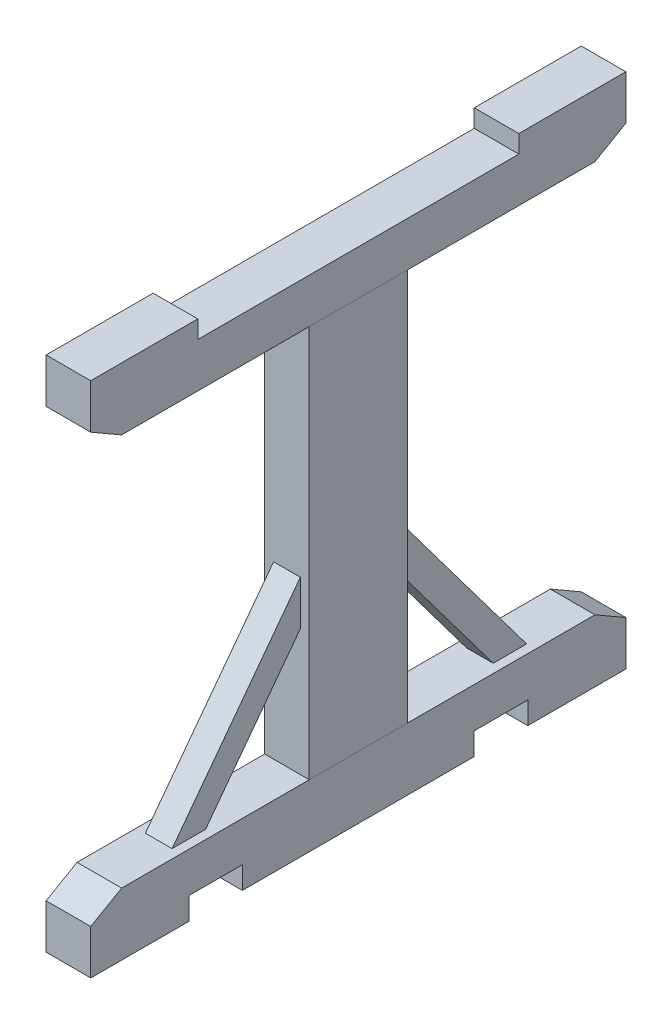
SolidWorks part; units mm, degrees
other "Main_support"
other "Upper_Brace2"
other "Upper_Brace1"
ref_plane "Front Plane" through (0, 0, 0) normal (0, 0, 1) x (1, 0, 0)
ref_plane "Top Plane" through (0, 0, 0) normal (0, 1, 0) x (1, 0, 0)
ref_plane "Right Plane" through (0, 0, 0) normal (1, 0, 0) x (0, 0, -1)
sketch3d "3DSketch1"
  line L3 (-35.8179, 0, 0) -> (-35.8179, 558.8, 0)
  line L4 (-35.8179, 558.8, 279.4) -> (-35.8179, 254, 0)
  line L7 (-35.8179, 558.8, 381) -> (-35.8179, 558.8, -381)
  line L10 (-35.8179, 254, 0) -> (-35.8179, 558.8, -279.4)
  line L14 (-35.8179, 0, 228.6) -> (-35.8179, 0, -228.6) construction
  line L17 (-35.8179, 304.8, 0) -> (-35.8179, 0, 228.6)
  line L18 (-35.8179, 304.8, 0) -> (-35.8179, 0, -228.6)
  line L19 (-35.8179, 0, 381) -> (-35.8179, 0, -381)
  line L22 (-35.8179, 0, 0) -> (-35.8179, -105.3822, 0) construction
  dimension "D1" = 762
  dimension "D2" = 762
  dimension "D4" = 457.2
  dimension "D3" = 558.8
  dimension "D6" = 558.8
  dimension "D7" = 304.8
  dimension "D9" = 304.8
other "Structural Member1"
ref_plane "Plane1" through (-35.8179, 558.8, 381) normal (0, 0, -1) x (0, -1, 0)
sketch "Sketch117" plane through (-4.0679, 647.7, 381) normal (0, 0, -1) x (0, -1, 0)
  line L0 (0, 31.75) -> (88.9, 31.75) construction
  line L1 (0, 0) -> (88.9, 0)
  line L2 (0, 0) -> (0, 63.5)
  line L3 (0, 63.5) -> (88.9, 63.5)
  line L4 (88.9, 0) -> (88.9, 63.5)
  point P7 (0, 0)
  dimension "D1" = 63.5
  dimension "D2" = 88.9
other "Structural Member2"
ref_plane "Plane2" through (-35.8179, 0, 0) normal (0, 1, 0) x (0, 0, -1)
sketch "Sketch1" plane through (-4.0679, 0, 69.85) normal (0, 1, 0) x (0, 0, -1)
  line L0 (0, 31.75) -> (139.7, 31.75) construction
  line L1 (0, 0) -> (139.7, 0)
  line L2 (0, 0) -> (0, 63.5)
  line L3 (0, 63.5) -> (139.7, 63.5)
  line L4 (139.7, 0) -> (139.7, 63.5)
  point P7 (69.85, 0)
  point P8 (69.85, 31.75)
  point P9 (69.85, 63.5)
  point P10 (0, 0)
  dimension "D1" = 63.5
  dimension "D2" = 139.7
other "Structural Member5"
ref_plane "Plane5" through (-35.8179, 304.8, 0) normal (0, -0.8, 0.6) x (0, 0.6, 0.8)
sketch "Sketch115" plane through (-16.7679, 293.37, -15.24) normal (0, -0.8, 0.6) x (0, 0.6, 0.8)
  line L0 (0, 38.1) -> (38.1, 0) construction
  line L1 (0, 0) -> (38.1, 0)
  line L2 (0, 0) -> (0, 38.1)
  line L3 (0, 38.1) -> (38.1, 38.1)
  line L4 (38.1, 0) -> (38.1, 38.1)
  line L5 (38.1, 38.1) -> (0, 0) construction
  point P4 (19.05, 0)
  point P5 (19.05, 19.05)
  point P7 (0, 19.05)
  point P8 (38.1, 19.05)
  point P9 (19.05, 38.1)
  point P10 (0, 0)
  dimension "D1" = 38.1
  dimension "D2" = 38.1
other "Trim/Extend5"
sketch "Sketch17" plane through (-4.0679, 0, 0) normal (1, 0, 0) x (0, 0, -1)
  line L0 (-228.6, 647.7) -> (-228.6, 622.3)
  line L2 (-228.6, 622.3) -> (228.6, 622.3)
  line L3 (228.6, 622.3) -> (228.6, 647.7)
  line L4 (381, 647.7) -> (-381, 647.7) construction
  line L9 (0, 117.2167) -> (0, 622.3) construction
  dimension "D1" = 457.2
  dimension "D3" = 25.4
extrude "Cut-Extrude1" cut sketch "Sketch17" against normal through all and the other way through all contours L0 L2 L3
chamfer "Chamfer1" distance 25.4 angle 60 2 edges at (-35.8179, 558.8, -381) (-35.8179, 558.8, 381)
sketch "Sketch19" plane through (-4.0679, 0, 0) normal (1, 0, 0) x (0, 0, -1)
  line L0 (0, 0) -> (0, -403.6391) construction
  line L3 (165.1, -88.9) -> (241.3, -88.9)
  line L4 (165.1, -88.9) -> (165.1, -57.15)
  line L5 (165.1, -57.15) -> (241.3, -57.15)
  line L6 (241.3, -88.9) -> (241.3, -57.15)
  line L7 (-241.3, -88.9) -> (-241.3, -57.15)
  line L8 (-165.1, -57.15) -> (-241.3, -57.15)
  line L9 (-165.1, -88.9) -> (-165.1, -57.15)
  line L10 (-165.1, -88.9) -> (-241.3, -88.9)
  line L11 (381, 0) -> (-381, 0) construction
  line L12 (381, -88.9) -> (-381, -88.9) construction
  dimension "D1" = 31.75
  dimension "D2" = 76.2
  dimension "D3" = 330.2
extrude "Cut-Extrude3" cut sketch "Sketch19" against normal up to next
ref_plane "Joining_Face" through (0, 0, 0) normal (0, 1, 0) x (-1, 0, 0)
sketch "Sketch4" plane through (0, 0, 0) normal (0, 1, 0) x (-1, 0, 0)
  line L0 (67.5679, -69.85) -> (4.0679, 69.85) construction
  line L1 (67.5679, -69.85) -> (67.5679, 69.85)
  line L2 (67.5679, -69.85) -> (4.0679, -69.85)
  line L3 (4.0679, -69.85) -> (4.0679, 69.85)
  line L4 (67.5679, 69.85) -> (4.0679, 69.85)
  line L5 (35.8179, -44.45) -> (35.8179, 44.45)
  line L6 (42.1679, -69.85) -> (42.1679, -68.85) construction
  line L7 (67.5679, -69.85) -> (42.1679, -69.85)
  line L8 (4.0679, -69.85) -> (4.0679, 69.85) construction
  point P13 (35.8179, 0)
  dimension "D1" = 88.9
  dimension "Dowel_side_inset" = 25.4
  dimension "Width" = 139.7
  dimension "Dowel_hole_end_gap" = 1
sketch "Master_sketch" plane through (0, 0, 0) normal (0, 1, 0) x (-1, 0, 0)
  circle A0 centre (35.8179, -44.45) radius 5.1
  circle A1 centre (35.8179, -44.45) radius 5
  dimension "Dowel_Diameter" = 10
  dimension "Dowel_Clearance" = 0.1
sketch "Sketch6" plane through (0, 0, 0) normal (0, 1, 0) x (-1, 0, 0)
  circle A0 centre (35.8179, -44.45) radius 5.1 construction
  circle A1 centre (35.8179, -44.45) radius 5.1
  circle A2 centre (35.8179, 44.45) radius 5.1
extrude "Cut-Extrude11" cut sketch "Sketch6" against normal mid plane 32
sketch "Sketch7" plane through (0, 0, 0) normal (0, 1, 0) x (-1, 0, 0)
  circle A0 centre (35.8179, -44.45) radius 5 construction
  circle A1 centre (35.8179, -44.45) radius 5
extrude "Dowel1" add sketch "Sketch7" along normal mid plane 30 separate body
sketch "Sketch8" plane through (0, 0, 0) normal (0, 1, 0) x (-1, 0, 0)
  circle A0 centre (35.8179, 44.45) radius 5
  circle A2 centre (35.8179, -44.45) radius 5 construction
extrude "Dowel2" add sketch "Sketch8" along normal mid plane 30 separate body
other "2 Dowels<1>"
ref_plane "Joining_Face1" [suppressed] through (0, 558.8, 0) normal (0, -1, 0) x (1, 0, 0)
sketch "Sketch41" [suppressed] plane through (0, 558.8, 0) normal (0, -1, 0) x (1, 0, 0)
  line L0 (-67.5679, 69.85) -> (-4.0679, -69.85) construction
  line L1 (-67.5679, 69.85) -> (-67.5679, -69.85)
  line L2 (-67.5679, 69.85) -> (-4.0679, 69.85)
  line L3 (-4.0679, 69.85) -> (-4.0679, -69.85)
  line L4 (-67.5679, -69.85) -> (-4.0679, -69.85)
  line L5 (-35.8179, 44.45) -> (-35.8179, -44.45)
  line L6 (-42.1679, 69.85) -> (-42.1679, 68.85) construction
  line L7 (-67.5679, 69.85) -> (-42.1679, 69.85)
  line L8 (-4.0679, 69.85) -> (-4.0679, -69.85) construction
  point P13 (-35.8179, 0)
  dimension "D1" = 88.9
  dimension "Dowel_side_inset" = 25.4
  dimension "Width" = 139.7
  dimension "Dowel_hole_end_gap" = 1
sketch "Master_sketch1" [suppressed] plane through (0, 558.8, 0) normal (0, -1, 0) x (1, 0, 0)
  circle A0 centre (-35.8179, 44.45) radius 5.1
  circle A1 centre (-35.8179, 44.45) radius 5
  dimension "Dowel_Diameter" = 10
  dimension "Dowel_Clearance" = 0.1
sketch "Sketch61" [suppressed] plane through (0, 558.8, 0) normal (0, -1, 0) x (1, 0, 0)
  circle A0 centre (-35.8179, 44.45) radius 5.1 construction
  circle A1 centre (-35.8179, 44.45) radius 5.1
  circle A2 centre (-35.8179, -44.45) radius 5.1
extrude "Cut-Extrude12" [suppressed] cut sketch "Sketch61" against normal mid plane 32
sketch "Sketch71" [suppressed] plane through (0, 558.8, 0) normal (0, -1, 0) x (1, 0, 0)
  circle A0 centre (-35.8179, 44.45) radius 5 construction
  circle A1 centre (-35.8179, 44.45) radius 5
extrude "Dowel11" [suppressed] add sketch "Sketch71" along normal mid plane 30 separate body
sketch "Sketch81" [suppressed] plane through (0, 558.8, 0) normal (0, -1, 0) x (1, 0, 0)
  circle A0 centre (-35.8179, -44.45) radius 5
  circle A2 centre (-35.8179, 44.45) radius 5 construction
extrude "Dowel21" [suppressed] add sketch "Sketch81" along normal mid plane 30 separate body
other "2 Dowels<2>" [suppressed]
hole_wizard "5/16 (0.3125) Diameter Hole1" positions "Sketch111" profile "Sketch112" hole size "5/16" standard "Ansi Inch"
sketch "Sketch111" plane through (-67.5679, 673.1, 0) normal (-1, 0, 0) x (0, 0, -1)
  point P0 (0, 746.9187)
  point P1 (273.05, 746.9187)
  point P2 (-273.05, 746.9187)
sketch "Sketch112" plane through (-67.5679, -73.8187, 0) normal (0, 1, 0) x (0, 0, 1)
  line L0 (0, 0) -> (0, 19.05)
  line L1 (0, 19.05) -> (3.9687, 19.05)
  line L2 (3.9687, 19.05) -> (3.9687, 0)
  line L5 (3.9687, 0) -> (0, 0)
  line L11 (0, -6.35) -> (0, 107.95) construction
  dimension "Thru Hole Dia." = 7.9375
  dimension "Thru Hole Depth" = 19.05
chamfer "Chamfer2" distance 25.4 angle 60 2 edges at (-35.8179, 0, 381) (-35.8179, 0, -381)
fillet "Fillet1" [suppressed] radius 12.7
fillet "Fillet2" [suppressed] radius 12.7
fillet "Fillet3" [suppressed] radius 2.54
fillet "Fillet4" [suppressed] radius 2.54
fillet "Fillet5" [suppressed] radius 2.54
fillet "Fillet6" [suppressed] radius 2.54
fillet "Fillet9" [suppressed] radius 6.35
fillet "Fillet10" [suppressed] radius 12.7
sketch "Sketch42" plane through (-17.5679, 222.25, 25) normal (0, -1, 0) x (0, 0, 1)
  line L0 (-25, 71.05) -> (-30.2625, 71.05) construction
  line L1 (-30.2625, 71.05) -> (-30.2625, 28.95) construction
  line L2 (-25, 28.95) -> (-30.2625, 28.95) construction
  line L3 (-25, 71.05) -> (-25, 28.95) construction
  line L4 (-25, 50) -> (-25, 82.4825) construction
  line L5 (-25, 71.05) -> (-30.2625, 71.05)
  line L6 (-30.2625, 71.05) -> (-30.2625, 28.95)
  line L7 (-25, 28.95) -> (-30.2625, 28.95)
  line L8 (-25, 71.05) -> (-25, 28.95)
  line L9 (-25, 50) -> (-25, 82.4825) construction
revolve "Cut-Revolve1" cut sketch "Sketch42" angle 360 about L9
other "Smart-Feature1<new_dowel_rod-1>"
equation "\"D1@Sketch4\" = \"Width@Sketch4\"-2*\"Dowel_side_inset@Sketch4\""
equation "\"Dowel_hole_length@Cut-Extrude11\" = \"Dowel_length@Dowel1\"+2*\"Dowel_hole_end_gap@Sketch4\""
equation "\"D1@Dowel2\" = \"Dowel_length@Dowel1\""
equation "\"D1@Sketch41\" = \"Width@Sketch41\"-2*\"Dowel_side_inset@Sketch41\""
equation "\"Dowel_hole_length@Cut-Extrude12\" = \"Dowel_length@Dowel11\"+2*\"Dowel_hole_end_gap@Sketch41\""
equation "\"D1@Dowel21\" = \"Dowel_length@Dowel11\""
